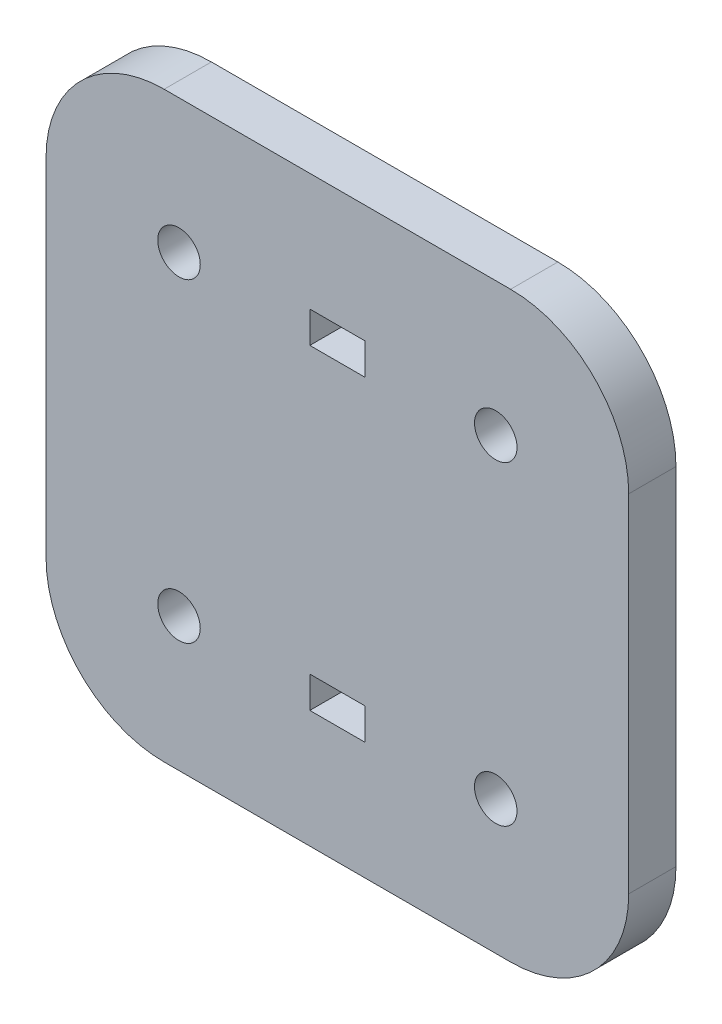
SolidWorks part; units mm, degrees
ref_plane "Front Plane" through (0, 0, 0) normal (0, 0, 1) x (1, 0, 0)
ref_plane "Top Plane" through (0, 0, 0) normal (0, 1, 0) x (1, 0, 0)
ref_plane "Right Plane" through (0, 0, 0) normal (1, 0, 0) x (0, 0, -1)
sketch "Sketch3" plane through (0, 0, 0) normal (0, 0, 1) x (1, 0, 0)
  line L8 (-10, -75.3307) -> (-13.5, -75.3307)
  line L20 (-13.5, -75.3307) -> (-13.5, -71.3307)
  line L25 (-13.5, -71.3307) -> (-6.5, -71.3307)
  line L31 (-6.5, -71.3307) -> (-6.5, -75.3307)
  line L38 (-47, -93.4042) -> (-47, -115.4042)
  line L39 (-32, -130.4042) -> (12, -130.4042)
  line L40 (27, -115.4042) -> (27, -71.4042)
  line L41 (12, -56.4042) -> (-32, -56.4042)
  line L42 (-47, -71.4042) -> (-47, -93.4042)
  line L52 (-6.5, -75.3307) -> (-10, -75.3307)
  line L54 (-6.5, -115.4776) -> (-6.5, -111.4776)
  line L55 (-13.5, -115.4776) -> (-6.5, -115.4776)
  line L56 (-13.5, -111.4776) -> (-13.5, -115.4776)
  line L57 (-10, -111.4776) -> (-13.5, -111.4776)
  line L58 (-6.5, -111.4776) -> (-10, -111.4776)
  circle A0 centre (-30.1133, -73.4042) radius 2.7
  circle A1 centre (10.1133, -73.4042) radius 2.7
  circle A2 centre (10.1133, -113.4042) radius 2.7
  circle A3 centre (-30.1133, -113.4042) radius 2.7
  arc A13 (12, -56.4042) -> (27, -71.4042) centre (12, -71.4042) cw
  arc A14 (27, -115.4042) -> (12, -130.4042) centre (12, -115.4042) cw
  arc A15 (-32, -130.4042) -> (-47, -115.4042) centre (-32, -115.4042) cw
  arc A16 (-32, -56.4042) -> (-47, -71.4042) centre (-32, -71.4042) ccw
  dimension "D1" = 15
extrude "Boss-Extrude2" add sketch "Sketch3" along normal blind 6
